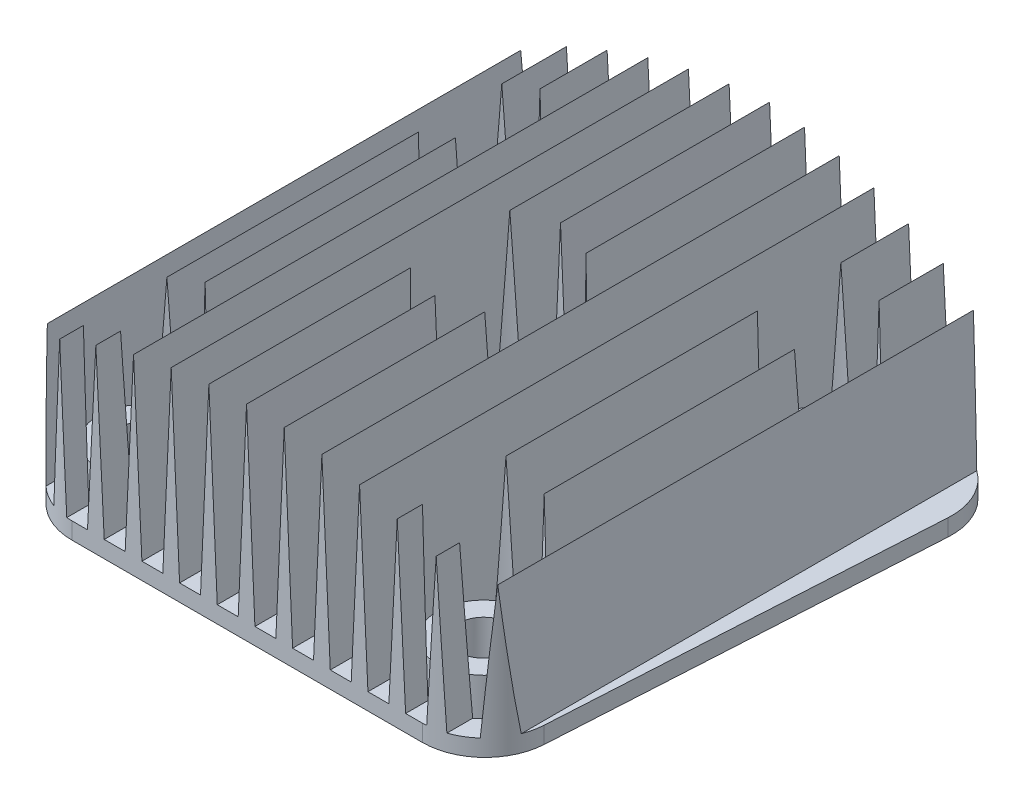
SolidWorks part; units mm, degrees
ref_plane "Front Plane" through (0, 0, 0) normal (0, 0, 1) x (1, 0, 0)
ref_plane "Top Plane" through (0, 0, 0) normal (0, 1, 0) x (1, 0, 0)
ref_plane "Right Plane" through (0, 0, 0) normal (1, 0, 0) x (0, 0, -1)
sketch "Sketch1" plane through (0, 0, 0) normal (0, 1, 0) x (1, 0, 0)
  line L0 (-56, -60) -> (56, -60)
  line L1 (56, -60) -> (63, 60)
  line L2 (63, 60) -> (0, 65)
  line L3 (0, 65) -> (-63, 60)
  line L4 (-63, 60) -> (-56, -60)
  line L5 (0, -60) -> (0, 65) construction
  dimension "D1" = 112
  dimension "D2" = 60
  dimension "D3" = 126
  dimension "D4" = 125
  dimension "D5" = 60
extrude "Boss-Extrude1" add sketch "Sketch1" along normal blind 4
fillet "Fillet1" radius 15 5 edges at (-63, 2, -60) (0, 2, -65) (63, 2, -60) (-56, 2, 60) (56, 2, 60)
sketch "Sketch2" plane through (0, 0, 0) normal (0, -1, 0) x (1, 0, 0)
  circle A0 centre (0, 0) radius 27.5
  dimension "D1" = 55
extrude "Boss-Extrude2" add sketch "Sketch2" along normal blind 4
sketch "Sketch3" plane through (0, 0, 0) normal (0, 0, 1) x (1, 0, 0)
  line L0 (0, 10.5114) -> (0, -9.5692) construction
  line L1 (0, 1.7356) -> (0, -4)
  line L2 (0, -4) -> (22.5, -4)
  line L3 (-27.5, -4) -> (27.5, -4) construction
  arc A0 (0, 1.7356) -> (22.5, -4) centre (0, -45.2644) cw
  dimension "D2" = 47
  dimension "D1" = 45
revolve "Cut-Revolve1" cut sketch "Sketch3" angle 360 about L0
sketch "Sketch4" plane through (0, 0, 0) normal (0, 0, 1) x (1, 0, 0)
  line L0 (-56.1446, 4) -> (-52.1446, 4)
  line L1 (-41.8495, 4) -> (-56.824, 4) construction
  line L2 (-52.1446, 4) -> (-54.1446, 35.4562)
  line L3 (-54.1446, 35.4562) -> (-56.1446, 4)
  line L4 (-54.1446, 4) -> (-54.1446, 35.4562) construction
  line L5 (-62.1446, 4) -> (-62.1446, 0) construction
  line L6 (-27.5, -4) -> (27.5, -4) construction
  arc A0 (-97.7909, -5.486) -> (96.5859, -3.5808) centre (0, -66) cw construction
  dimension "D1" = 115
  dimension "D2" = 4
  dimension "D3" = 6
  dimension "D4" = 62
extrude "Boss-Extrude3" add sketch "Sketch4" along normal mid plane 130
pattern_linear "LPattern1" count 13 spacing 9 of "Boss-Extrude3"
sketch "Sketch5" plane through (0, 0, 0) normal (0, -1, 0) x (1, 0, 0)
  line L5 (-56.824, 45.8735) -> (-62.1446, -45.3357)
  line L6 (-48.3568, -61.1622) -> (-1.1867, -64.9058)
  line L7 (1.1867, -64.9058) -> (48.3568, -61.1622)
  line L8 (62.1446, -45.3357) -> (56.824, 45.8735)
  line L9 (41.8495, 60) -> (-41.8495, 60)
  line L10 (-56.824, 45.8735) -> (-62.1446, -45.3357)
  line L11 (-48.3568, -61.1622) -> (-1.1867, -64.9058)
  line L12 (1.1867, -64.9058) -> (48.3568, -61.1622)
  line L13 (62.1446, -45.3357) -> (56.824, 45.8735)
  line L14 (41.8495, 60) -> (-41.8495, 60)
  arc A5 (-62.1446, -45.3357) -> (-48.3568, -61.1622) centre (-47.17, -46.2092) ccw
  arc A6 (-1.1867, -64.9058) -> (1.1867, -64.9058) centre (0, -49.9528) ccw
  arc A7 (48.3568, -61.1622) -> (62.1446, -45.3357) centre (47.17, -46.2092) ccw
  arc A8 (56.824, 45.8735) -> (41.8495, 60) centre (41.8495, 45) ccw
  arc A9 (-41.8495, 60) -> (-56.824, 45.8735) centre (-41.8495, 45) ccw
  arc A10 (-62.1446, -45.3357) -> (-48.3568, -61.1622) centre (-47.17, -46.2092) ccw
  arc A11 (-1.1867, -64.9058) -> (1.1867, -64.9058) centre (0, -49.9528) ccw
  arc A12 (48.3568, -61.1622) -> (62.1446, -45.3357) centre (47.17, -46.2092) ccw
  arc A13 (56.824, 45.8735) -> (41.8495, 60) centre (41.8495, 45) ccw
  arc A14 (-41.8495, 60) -> (-56.824, 45.8735) centre (-41.8495, 45) ccw
  dimension "D1" = 0
extrude "Cut-Extrude1" cut sketch "Sketch5" against normal blind 130 flip side to cut
sketch "Sketch6" plane through (0, 4, 0) normal (0, 1, 0) x (1, 0, 0)
  line L0 (-34.1446, -60) -> (-29.1446, -60) construction
  circle A0 centre (-40.5, -44) radius 11
  dimension "D2" = 40.5
  dimension "D4" = 22
  dimension "D1" = 16
extrude "Cut-Extrude2" cut sketch "Sketch6" along normal blind 130
sketch "Sketch7" plane through (0, 4, 0) normal (0, 1, 0) x (1, 0, 0)
  circle A0 centre (-40.5, -44) radius 11
  arc A1 (-43.1446, -33.3226) -> (-47.1446, -35.2336) centre (-40.5, -44) ccw construction
extrude "Boss-Extrude4" add sketch "Sketch7" along normal blind 9
sketch "Sketch9" plane through (0, 4, 0) normal (0, 1, 0) x (1, 0, 0)
  circle A0 centre (0, 0) radius 15
  dimension "D1" = 30
extrude "Cut-Extrude4" cut sketch "Sketch9" along normal blind 92
sketch "Sketch10" plane through (0, 4, 0) normal (0, 1, 0) x (1, 0, 0)
  circle A0 centre (0, 0) radius 15
  arc A1 (-7.1446, 13.1892) -> (-11.1446, 10.0398) centre (0, 0) ccw construction
extrude "Boss-Extrude5" add sketch "Sketch10" along normal blind 9
sketch "Sketch8" plane through (0, 13, 0) normal (0, 1, 0) x (1, 0, 0)
  circle A0 centre (-40.5, -44) radius 6
  dimension "D1" = 12
extrude "Cut-Extrude3" cut sketch "Sketch8" against normal up to surface (9 mm away)
pattern_linear "LPattern2" count 2 spacing 81 along (1, 0, 0) count 2 spacing 80 along (0, 0, -1) of "Cut-Extrude2", "Boss-Extrude4", "Cut-Extrude3"
hole_wizard "M18x1.5 Tapped Hole1" positions "Sketch12" profile "Sketch11" tap size "M18x1.5" standard "Ansi Metric"
sketch "Sketch12" plane through (0, 13, 0) normal (0, 1, 0) x (-1, 0, 0)
  arc A0 (10.7413, -10.4702) -> (10.7413, 10.4702) centre (0, 0) ccw construction
  point P0 (0, 0)
sketch "Sketch11" plane through (0, 13, 0) normal (1, 0, 0) x (0, 0, 1)
  line L0 (0, 0) -> (0, 17)
  line L1 (0, 17) -> (8.25, 17)
  line L2 (8.25, 17) -> (8.25, 0)
  line L5 (8.25, 0) -> (0, 0)
  line L11 (0, -6.35) -> (0, 107.95) construction
  dimension "Thru Tap Drill Dia." = 16.5
  dimension "Thru Tap Drill Depth" = 17
